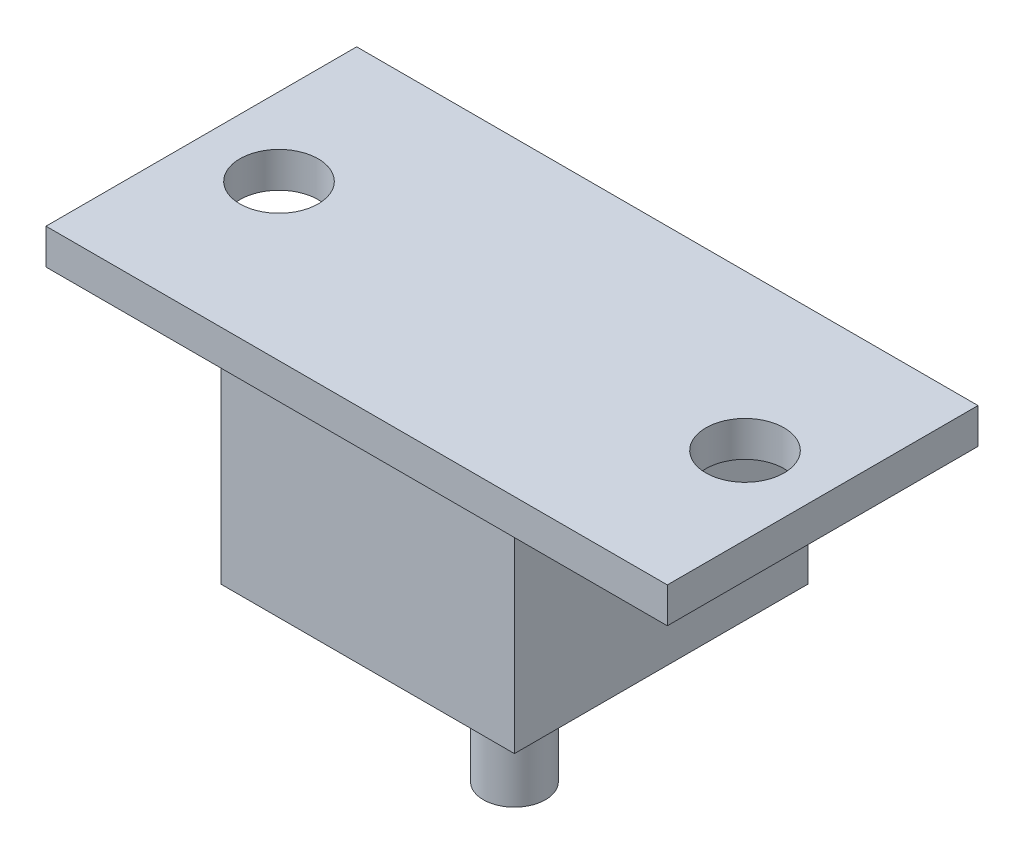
SolidWorks part; units mm, degrees
ref_plane "Front" through (0, 0, 0) normal (0, 0, 1) x (1, 0, 0)
ref_plane "Top" through (0, 0, 0) normal (0, 1, 0) x (1, 0, 0)
ref_plane "Right" through (0, 0, 0) normal (1, 0, 0) x (0, 0, -1)
sketch "Sketch1" plane through (0, 0, 0) normal (0, 1, 0) x (1, 0, 0)
  line L1 (0, 0) -> (25.4, 0)
  line L2 (0, 0) -> (0, 12.7)
  line L3 (0, 12.7) -> (25.4, 12.7)
  line L4 (25.4, 0) -> (25.4, 12.7)
  dimension "D1" = 25.4
  dimension "D2" = 12.7
extrude "Boss-Extrude1" add sketch "Sketch1" along normal blind 1.4478
hole_wizard "M3 Clearance Hole3" positions "Sketch9" profile "Sketch3" hole size "M3" standard "ANSI Metric"
sketch "Sketch9" plane through (0, 1.4478, 0) normal (0, 1, 0) x (1, 0, 0)
  line L0 (3.175, 6.35) -> (22.225, 6.35) construction
  line L5 (0, 12.7) -> (0, 0) construction
  line L6 (25.4, 12.7) -> (0, 12.7) construction
  point P0 (3.175, 6.35)
  point P2 (22.225, 6.35)
  point P19 (0, 6.35)
  point P25 (12.7, 12.7)
  point P26 (12.7, 6.35)
  dimension "D1" = 19.05
sketch "Sketch3" plane through (3.175, 1.4478, -6.35) normal (1, 0, 0) x (0, 0, 1)
  line L0 (0, 0) -> (0, 1.4478)
  line L1 (0, 1.4478) -> (1.6, 1.4478)
  line L2 (1.6, 1.4478) -> (1.6, 0)
  line L5 (1.6, 0) -> (0, 0)
  line L11 (0, -6.35) -> (0, 107.95) construction
  dimension "Thru Hole Dia." = 3.2
  dimension "Thru Hole Depth" = 1.4478
sketch "Sketch5" plane through (0, 0, 0) normal (0, -1, 0) x (1, 0, 0)
  line L1 (6.7995, -0.3493) -> (18.7995, -0.3493)
  line L2 (6.7995, -0.3493) -> (6.7995, -12.3493)
  line L3 (6.7995, -12.3493) -> (18.7995, -12.3493)
  line L4 (18.7995, -0.3493) -> (18.7995, -12.3493)
  dimension "D1" = 12
  dimension "D2" = 12
extrude "Boss-Extrude2" add sketch "Sketch5" along normal blind 8
sketch "Sketch6" plane through (0, -8, -15.5425) normal (0, 1, 0) x (-1, 0, 0)
  line L0 (-18.7995, 15.1933) -> (-6.7995, 3.1933) construction
  circle A0 centre (-12.7995, 9.1933) radius 1.27
  point P2 (-13.9597, -2)
  dimension "D1" = 2.54
extrude "Boss-Extrude3" add sketch "Sketch6" against normal blind 7
